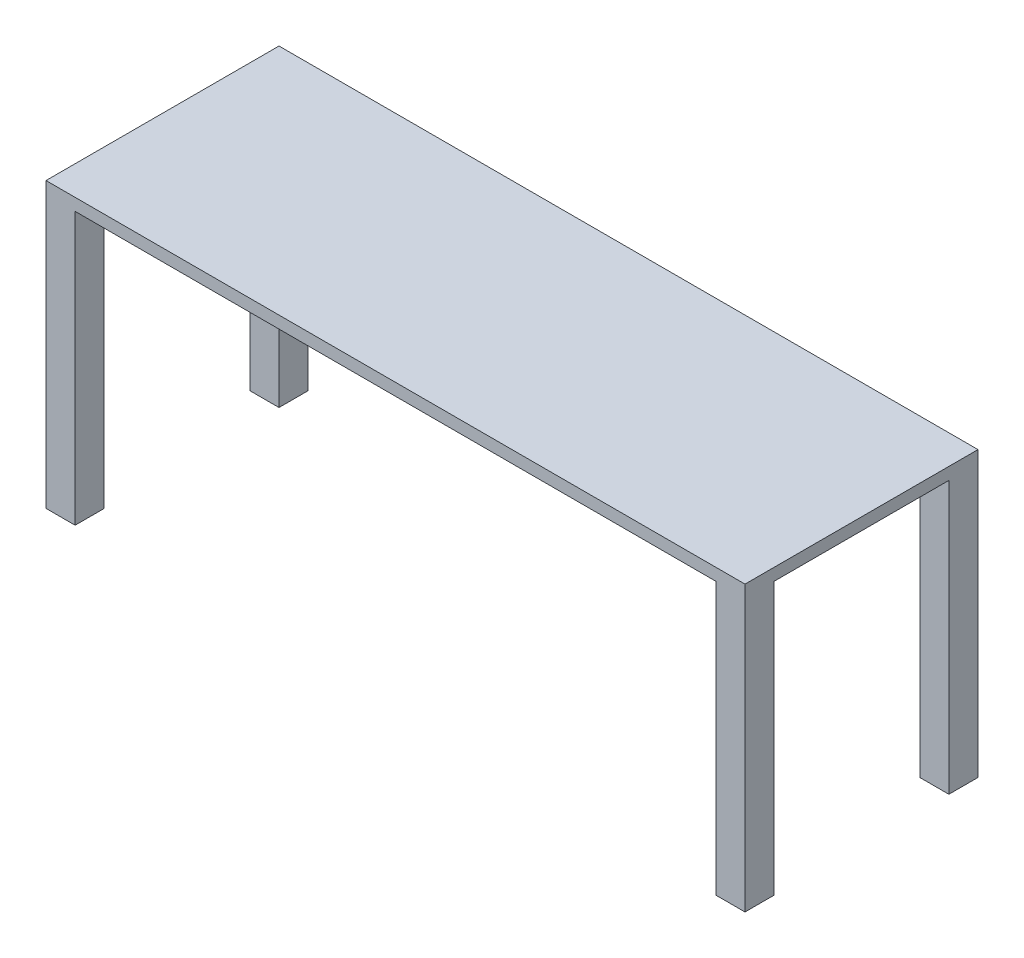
SolidWorks part; units mm, degrees
ref_plane "Front Plane" through (0, 0, 0) normal (0, 0, 1) x (1, 0, 0)
ref_plane "Top Plane" through (0, 0, 0) normal (0, 1, 0) x (1, 0, 0)
ref_plane "Right Plane" through (0, 0, 0) normal (1, 0, 0) x (0, 0, -1)
sketch "Sketch1" plane through (0, 0, 0) normal (0, 1, 0) x (1, 0, 0)
  line L1 (0, 609.6) -> (1828.8, 609.6)
  line L2 (0, 609.6) -> (0, 0)
  line L3 (0, 0) -> (1828.8, 0)
  line L4 (1828.8, 609.6) -> (1828.8, 0)
  point P4 (0, 0)
  dimension "D1" = 1828.8
  dimension "D2" = 609.6
extrude "Boss-Extrude1" add sketch "Sketch1" along normal blind 31.75
sketch "Sketch2" plane through (0, 0, 0) normal (0, -1, 0) x (1, 0, 0)
  line L0 (914.4, 0) -> (914.4, -609.6) construction
  line L1 (0, 0) -> (76.2, 0)
  line L2 (0, 0) -> (0, -76.2)
  line L3 (0, -76.2) -> (76.2, -76.2)
  line L4 (76.2, 0) -> (76.2, -76.2)
  line L5 (0, 0) -> (1828.8, 0) construction
  line L6 (1828.8, -609.6) -> (0, -609.6) construction
  line L7 (1828.8, -304.8) -> (0, -304.8) construction
  line L8 (1828.8, 0) -> (1828.8, -609.6) construction
  line L9 (0, -609.6) -> (0, 0) construction
  line L10 (0, -533.4) -> (76.2, -533.4)
  line L11 (76.2, -609.6) -> (76.2, -533.4)
  line L12 (0, -609.6) -> (76.2, -609.6)
  line L13 (0, -609.6) -> (0, -533.4)
  line L14 (1828.8, -609.6) -> (1828.8, -533.4)
  line L15 (1828.8, -609.6) -> (1752.6, -609.6)
  line L16 (1752.6, -609.6) -> (1752.6, -533.4)
  line L17 (1828.8, -533.4) -> (1752.6, -533.4)
  line L18 (1828.8, -76.2) -> (1752.6, -76.2)
  line L19 (1752.6, 0) -> (1752.6, -76.2)
  line L20 (1828.8, 0) -> (1752.6, 0)
  line L21 (1828.8, 0) -> (1828.8, -76.2)
  dimension "D1" = 76.2
  dimension "D2" = 76.2
extrude "Boss-Extrude2" add sketch "Sketch2" along normal blind 711.2 contours L2 L1 L4 L3 | L10 L11 L12 L13 | L18 L19 L20 L21 | L14 L17 L16 L15
